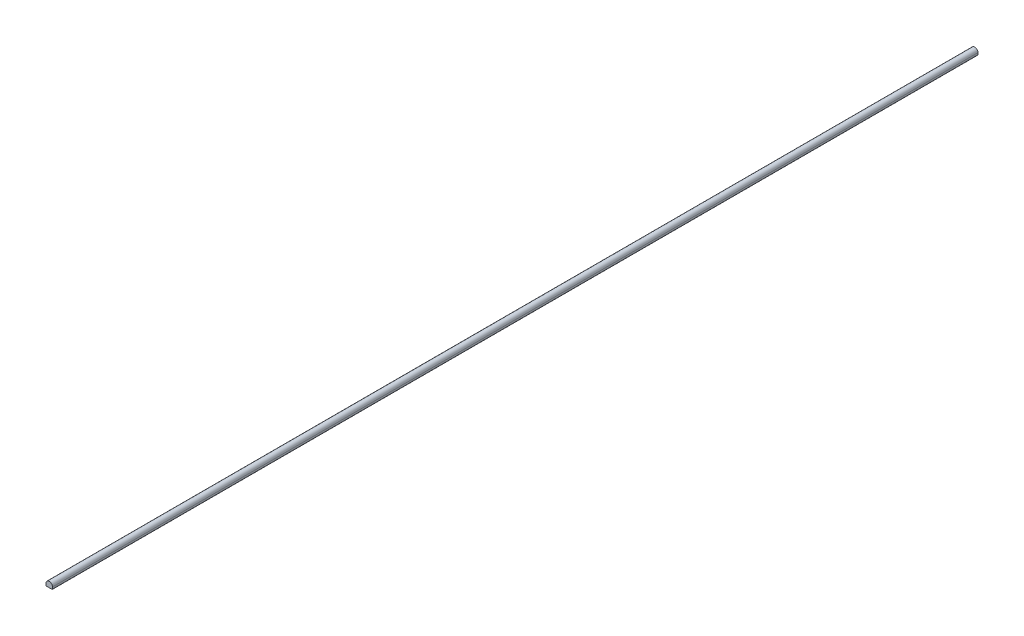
SolidWorks part; units mm, degrees
ref_plane "Plane1" through (0, 0, 0) normal (0, 0, 1) x (1, 0, 0)
ref_plane "Plane2" through (0, 0, 0) normal (0, 1, 0) x (1, 0, 0)
ref_plane "Plane3" through (0, 0, 0) normal (1, 0, 0) x (0, 0, -1)
sketch "Эскиз1" plane through (0, 0, 0) normal (0, 0, 1) x (1, 0, 0)
  line L0 (0, 0) -> (0, 5)
  line L1 (14, 5) -> (14, 0)
  line L2 (14, 0) -> (0, 0)
  line L3 (7, 12) -> (7, 0) construction
  arc A0 (0, 5) -> (14, 5) centre (7, 5) cw
  dimension "D1" = 14
  dimension "D2" = 12
extrude "Бобышка-Вытянуть1" add sketch "Эскиз1" along normal blind 2000
fillet "Скругление1" radius 1
sketch "Эскиз2" [suppressed] plane through (0, 0, 0) normal (0, 0, -1) x (-1, 0, 0)
  line L3 (-13, 0) -> (-1, 0)
  line L4 (0, 1) -> (0, 5)
  line L5 (-14, 5) -> (-14, 1)
  line L6 (-13, 0) -> (-1, 0)
  line L7 (0, 1) -> (0, 5)
  line L8 (-14, 5) -> (-14, 1)
  arc A3 (-1, 0) -> (0, 1) centre (-1, 1) ccw
  arc A4 (0, 5) -> (-14, 5) centre (-7, 5) ccw
  arc A5 (-14, 1) -> (-13, 0) centre (-13, 1) ccw
  arc A6 (-1, 0) -> (0, 1) centre (-1, 1) ccw
  arc A7 (0, 5) -> (-14, 5) centre (-7, 5) ccw
  arc A8 (-14, 1) -> (-13, 0) centre (-13, 1) ccw
  dimension "D1" = 0
extrude "Вырез-Вытянуть1" [suppressed] cut sketch "Эскиз2" against normal blind 45.6
